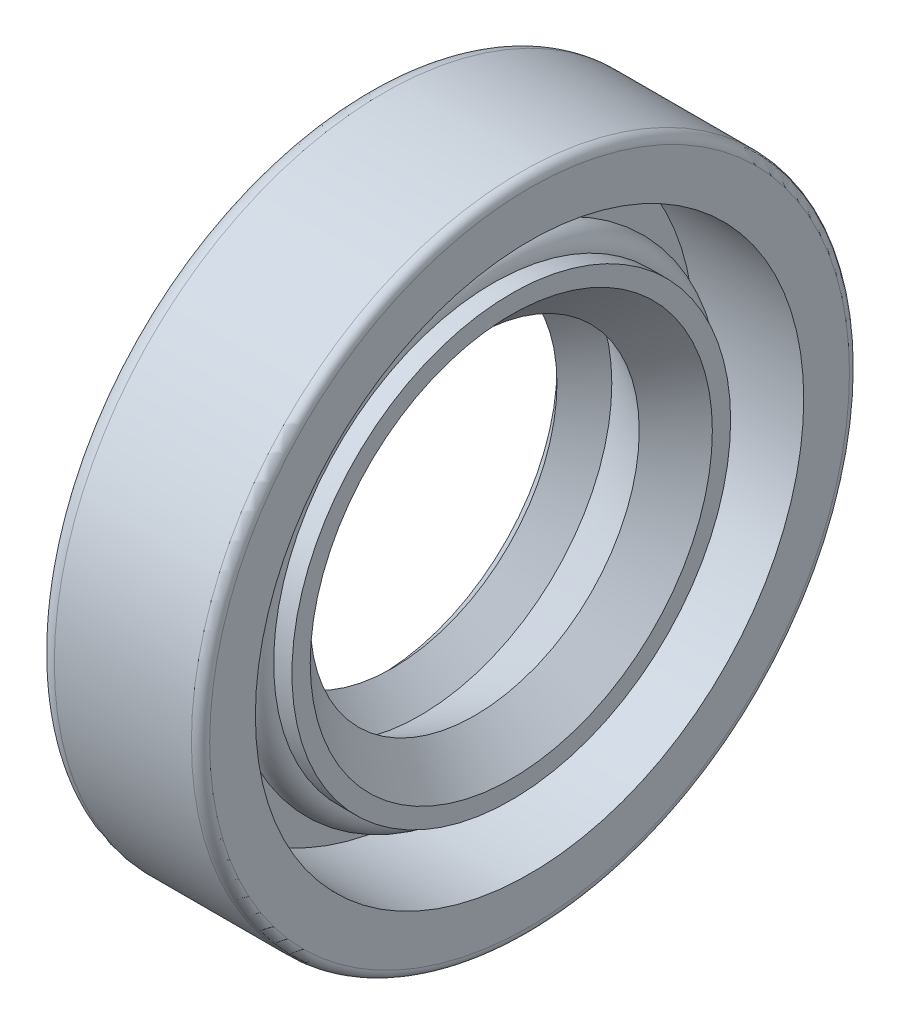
SolidWorks part; units mm, degrees
ref_plane "Piano frontale" through (0, 0, 0) normal (0, 0, 1) x (1, 0, 0)
ref_plane "Piano superiore" through (0, 0, 0) normal (0, 1, 0) x (1, 0, 0)
ref_plane "Piano destro" through (0, 0, 0) normal (1, 0, 0) x (0, 0, -1)
sketch "Schizzo1" plane through (0, 0, 0) normal (0, 0, 1) x (1, 0, 0)
  line L0 (0, 0) -> (-15.2015, 0) construction
  line L1 (5.5, 0) -> (-5.5, 0) construction
  line L72 (0, 18.8889) -> (0, 16.6667)
  line L73 (0, 16.6667) -> (0.2, 16.6667)
  line L74 (0.2, 16.6667) -> (0.2, 13.3333)
  line L75 (0.2, 13.3333) -> (0, 13.3333)
  line L76 (0, 13.3333) -> (0, 12.5)
  line L77 (0, 12.5) -> (1.6667, 11.6667)
  line L78 (1.6667, 11.6667) -> (0.8333, 10.8333)
  line L79 (0.8333, 10.8333) -> (1.6667, 10)
  line L80 (1.6667, 10) -> (3.3333, 11.6667)
  line L81 (3.3333, 11.6667) -> (6.6667, 10)
  line L82 (6.6667, 10) -> (8.8889, 12.2222)
  line L83 (8.8889, 12.2222) -> (8.8889, 13.3333)
  line L84 (8.8889, 13.3333) -> (7.7778, 13.3333)
  line L85 (5.5556, 13.3333) -> (3.8889, 13.3333)
  line L86 (3.3333, 13.8889) -> (3.3333, 16.6667)
  line L87 (3.3333, 16.6667) -> (10, 16.6667)
  line L88 (10, 16.6667) -> (10, 19.4444)
  line L89 (9.4444, 20) -> (1.1111, 20)
  arc A16 (7.7778, 13.3333) -> (5.5556, 13.3333) centre (6.6667, 13.3333) ccw
  arc A17 (3.3333, 13.8889) -> (3.8889, 13.3333) centre (3.8889, 13.8889) ccw
  arc A18 (10, 19.4444) -> (9.4444, 20) centre (9.4444, 19.4444) ccw
  arc A19 (1.1111, 20) -> (0, 18.8889) centre (1.1111, 18.8889) ccw
revolve "Rivoluzione1" add sketch "Schizzo1" angle 360 about L0
